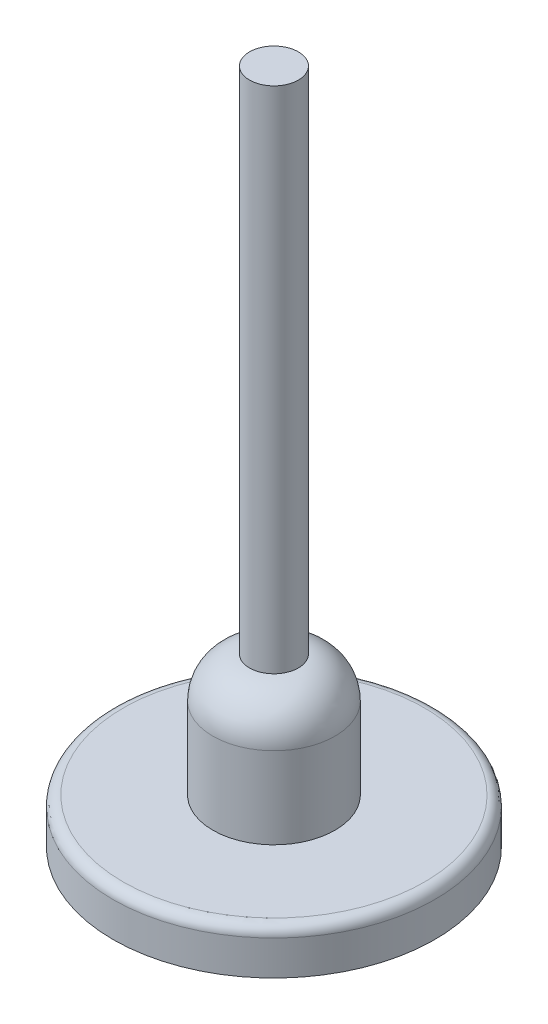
SolidWorks part; units mm, degrees
ref_plane "Plan de face" through (0, 0, 0) normal (0, 0, 1) x (1, 0, 0)
ref_plane "Plan de dessus" through (0, 0, 0) normal (0, 1, 0) x (1, 0, 0)
ref_plane "Plan de droite" through (0, 0, 0) normal (1, 0, 0) x (0, 0, -1)
sketch "Esquisse1" plane through (0, 0, 0) normal (0, 1, 0) x (1, 0, 0)
  circle A0 centre (0, 0) radius 39.5
  dimension "D1" = 79
extrude "Extrusion1" add sketch "Esquisse1" along normal blind 11
fillet "Congé1" radius 2.5 1 edges at (0, 11, 39.5)
sketch "Esquisse2" plane through (0, 11, 0) normal (0, 1, 0) x (-1, 0, 0)
  circle A0 centre (0, 0) radius 15
extrude "Extrusion2" add sketch "Esquisse2" along normal blind 30
fillet "Congé3" radius 10 1 edges at (0, 41, 15)
sketch "Esquisse4" plane through (0, 41, 0) normal (0, 1, 0) x (1, 0, 0)
  circle A0 centre (0, 0) radius 6
  dimension "D1" = 12
extrude "Extrusion3" add sketch "Esquisse4" along normal blind 125
